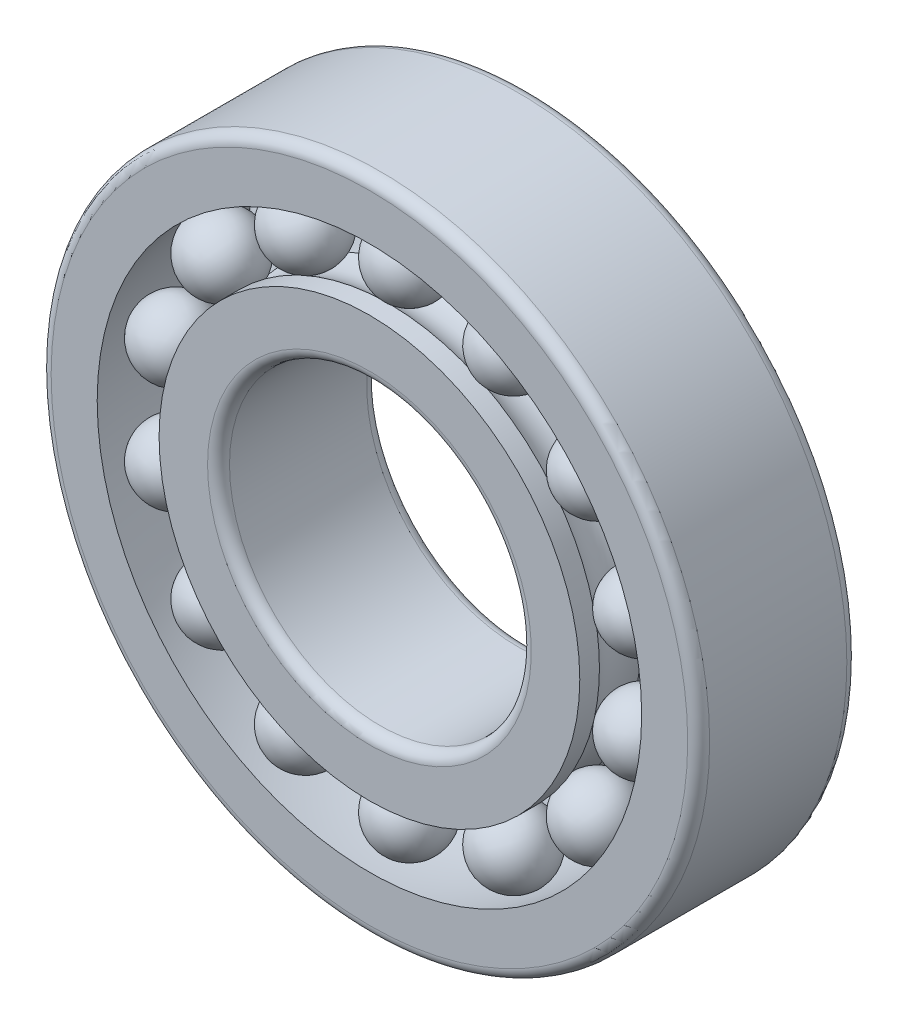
SolidWorks part; units mm, degrees
ref_plane "Front Plane" through (0, 0, 0) normal (0, 0, 1) x (1, 0, 0)
ref_plane "Top Plane" through (0, 0, 0) normal (0, 1, 0) x (1, 0, 0)
ref_plane "Right Plane" through (0, 0, 0) normal (1, 0, 0) x (0, 0, -1)
other "Configuration Table"
sketch "BaseSke" plane through (0, 0, 0) normal (1, 0, 0) x (0, 0, -1)
  line L0 (-47.2296, 0) -> (24.6132, 0) construction
  line L1 (-47.2296, 43.75) -> (24.6132, 43.75) construction
  line L2 (0, 129.5214) -> (0, -86.3012) construction
  line L3 (-7.1841, 50.3409) -> (-7.1841, 37.1591)
  line L4 (-14.5, 60) -> (14.5, 60) construction
  line L5 (-14.5, 27.5) -> (14.5, 27.5) construction
  line L6 (-14.5, 60) -> (-14.5, 27.5) construction
  line L7 (14.5, 60) -> (14.5, 27.5) construction
  line L8 (-13.775, 60) -> (-13.775, 27.5) construction
  arc A0 (-7.1841, 50.3409) -> (-7.1841, 37.1591) centre (-7.1841, 43.75) ccw
revolve "Ball" add sketch "BaseSke" angle 360 about L3
sketch "OuterRaceSke" plane through (0, 0, 0) normal (1, 0, 0) x (0, 0, -1)
  line L0 (0, 0) -> (0, 87.5396) construction
  line L1 (-14.5, 60) -> (14.5, 60)
  line L2 (-14.5, 60) -> (-14.5, 49.6108)
  line L4 (14.5, 60) -> (14.5, 49.6108)
  line L5 (-50.3916, 0) -> (55.2197, 0) construction
  arc A0 (-14.5, 49.6108) -> (14.5, 49.6108) centre (0, -59.4293) cw
  arc A1 (-14.5, 49.631) -> (14.5, 49.631) centre (0, -59.4293) cw construction
  arc A2 (-7.1841, 50.3409) -> (-7.1841, 37.1591) centre (-7.1841, 43.75) ccw construction
revolve "OuterRace" add sketch "OuterRaceSke" angle 360 about L5
mirror "MirrorBall" about plane through (0, 0, 0) normal (0, 0, 1) of "Ball"
sketch "InnerRaceSke" plane through (0, 0, 0) normal (1, 0, 0) x (0, 0, -1)
  line L0 (-70.8626, 0) -> (113.5527, 0) construction
  line L1 (0, 58.441) -> (0, -70.8113) construction
  line L2 (-14.5, 27.5) -> (14.5, 27.5)
  line L3 (-14.5, 27.5) -> (-14.5, 38.3333)
  line L4 (-14.5, 38.3333) -> (-10.9215, 38.3333)
  line L5 (14.5, 27.5) -> (14.5, 38.3333)
  line L6 (0, 129.5214) -> (0, -86.3012) construction
  line L7 (-3.4467, 38.3333) -> (3.4467, 38.3333)
  line L8 (14.5, 38.3333) -> (10.9215, 38.3333)
  arc A0 (-10.9215, 38.3333) -> (-3.4467, 38.3333) centre (-7.1841, 43.75) ccw
  circle A1 centre (-7.1841, 43.75) radius 6.5909 construction
  arc A2 (10.9215, 38.3333) -> (3.4467, 38.3333) centre (7.1841, 43.75) cw
  point P17 (0, 27.5)
  point P23 (0, 38.3333)
revolve "InnerRace" add sketch "InnerRaceSke" angle 360 about L0
fillet "Fillet1" radius 2 4 edges at (27.5, 0, -14.5) (27.5, 0, 14.5) (60, 0, -14.5) (60, 0, 14.5)
pattern_circular "CirPatternBall" count 14 over 360 about axis through (0, 0, 0) along (0, 0, 1) of "Ball", "MirrorBall"
sketch "TaperSke" plane through (0, 0, 0) normal (1, 0, 0) x (0, 0, -1)
  line L0 (-14.5, 27.5) -> (14.5, 27.5)
  line L1 (14.5, 27.5) -> (14.5, 29.9167)
  line L2 (14.5, 29.9167) -> (-14.5, 27.5)
  line L7 (-41.2502, 0) -> (40.8606, 0) construction
revolve "Taper" [suppressed] cut sketch "TaperSke" angle 360 about L7
fillet "Fillet2" [suppressed] radius 2
sketch "SimplifiedSke" plane through (0, 0, 0) normal (1, 0, 0) x (0, 0, -1)
  line L0 (37.5911, 0) -> (-37.5911, 0) construction
  line L1 (0, 0) -> (0, 72.9012) construction
  circle A0 centre (-7.1841, 43.75) radius 6.5909
  circle A1 centre (-7.1841, 43.75) radius 6.5909 construction
  circle A2 centre (7.1841, 43.75) radius 6.5909
revolve "Simplified" [suppressed] add sketch "SimplifiedSke" angle 360 about L0
equation "\"D1@BaseSke\" =  (\"Bearing_Outside_Diameter@BaseSke\"  +  \"Bearing_Inside_Diameter@BaseSke\"  )  / 4"
equation "\"Ball_diameter@BaseSke\" = \"Bearing_Thickness@BaseSke\" / 2.2"
equation "\"D2@BaseSke\" = \"Bearing_Thickness@BaseSke\"/40"
equation "\"D1@InnerRaceSke\" = \"Bearing_Inside_Diameter@BaseSke\" +  ( \"Bearing_Outside_Diameter@BaseSke\" - \"Bearing_Inside_Diameter@BaseSke\" )  / 3"
equation "\"D1@CirPatternBall\" = int( \"D1@BaseSke\"* pi  * 2 / \"Ball_diameter@BaseSke\" /1.4)"
equation "\"Taper@TaperSke\" = \"Bearing_Thickness@BaseSke\"/12"
equation "\"D1@Fillet2\" = \"Fillet_radius@Fillet1\""
equation "\"D2@InnerRaceSke\" = \"Ball_diameter@BaseSke\"-0.02"
equation "\"D1@OuterRaceSke\" = \"Bearing_Inside_Diameter@BaseSke\"*2"
